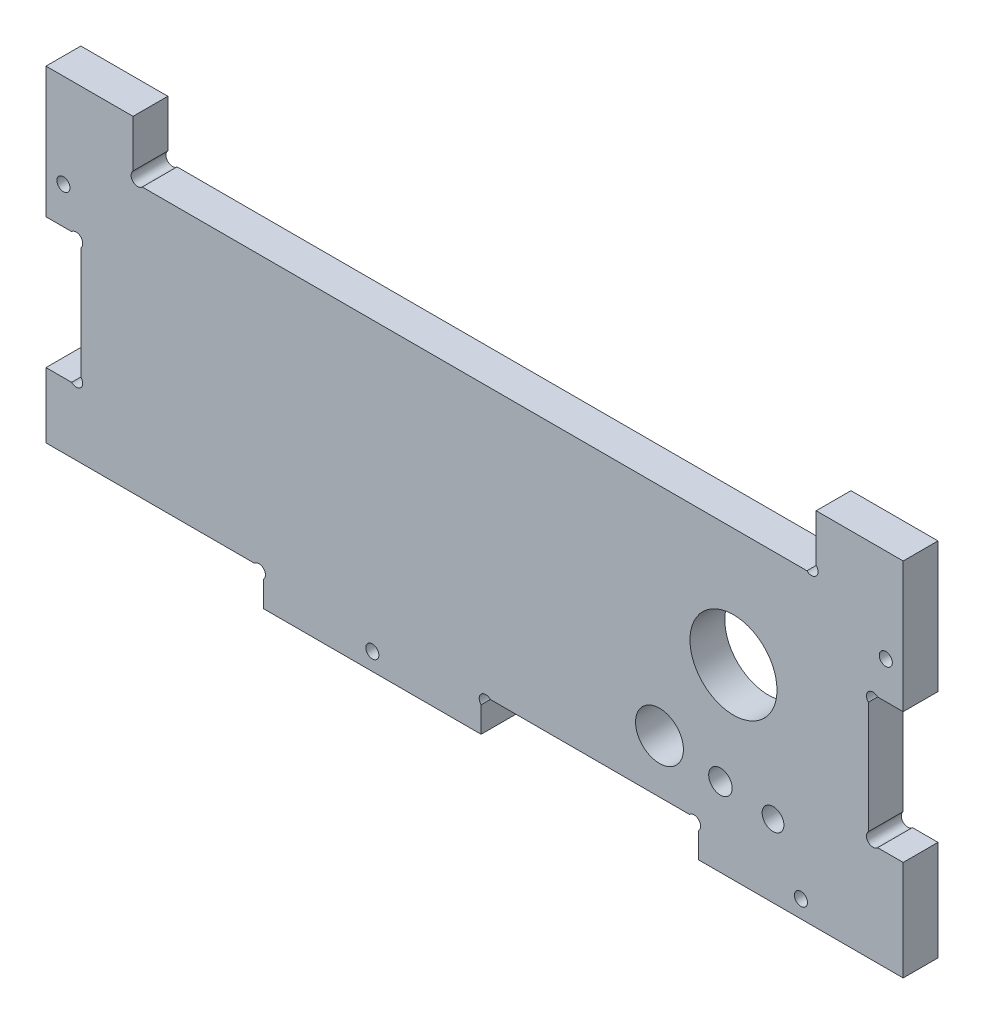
SolidWorks part; units mm, degrees
ref_plane "Plan de face" through (0, 0, 0) normal (0, 0, 1) x (1, 0, 0)
ref_plane "Plan de dessus" through (0, 0, 0) normal (0, 1, 0) x (1, 0, 0)
ref_plane "Plan de droite" through (0, 0, 0) normal (1, 0, 0) x (0, 0, -1)
sketch "Esquisse1" plane through (0, 0, 0) normal (0, 0, 1) x (1, 0, 0)
  line L0 (-176.8157, 28.3831) -> (-176.8157, 45.3831)
  line L1 (20.1843, 45.3831) -> (20.1843, 58.3831)
  line L2 (-176.8157, -16.6169) -> (-176.8157, -1.6169)
  line L3 (20.1843, 45.3831) -> (20.1843, 28.3831)
  line L4 (20.1843, -16.6169) -> (20.1843, -24.6169)
  line L5 (20.1843, -1.6169) -> (14.3056, -1.6169)
  line L6 (12.1843, 0.5044) -> (12.1843, 26.2618)
  line L7 (14.3056, 28.3831) -> (20.1843, 28.3831)
  line L8 (-154.6944, 45.3831) -> (-118.937, 45.3831)
  line L9 (20.1843, -1.6169) -> (20.1843, -16.6169)
  line L10 (-126.8157, -24.6169) -> (-76.8157, -16.6169) construction
  line L11 (20.1843, 58.3831) -> (0.1843, 58.3831)
  line L12 (20.1843, -24.6169) -> (-26.8157, -24.6169)
  line L13 (-26.8157, -24.6169) -> (-26.8157, -18.7382)
  line L14 (-74.6944, -16.6169) -> (-28.937, -16.6169)
  line L15 (-26.8157, -24.6169) -> (20.1843, -16.6169) construction
  line L16 (-76.8157, -18.7382) -> (-76.8157, -24.6169)
  line L17 (-76.8157, -24.6169) -> (-126.8157, -24.6169)
  line L18 (-126.8157, -24.6169) -> (-126.8157, -18.7382)
  line L19 (-128.937, -16.6169) -> (-176.8157, -16.6169)
  line L20 (0.1843, 58.3831) -> (0.1843, 47.5044)
  line L21 (-118.937, 45.3831) -> (-1.937, 45.3831)
  line L22 (-1.937, 47.5044) -> (-12.4859, 58.0533) construction
  line L23 (-176.8157, 45.3831) -> (-176.8157, 58.3831)
  line L24 (-176.8157, 58.3831) -> (-156.8157, 58.3831)
  line L25 (-176.8157, -1.6169) -> (-170.937, -1.6169)
  line L26 (-156.8157, 58.3831) -> (-156.8157, 47.5044)
  line L27 (-168.8157, 0.5044) -> (-168.8157, 26.2618)
  line L28 (-170.937, 28.3831) -> (-176.8157, 28.3831)
  line L29 (12.1843, 28.3831) -> (19.7175, 20.85) construction
  line L30 (-156.8157, 45.3831) -> (-143.6704, 58.5284) construction
  line L31 (-176.8157, 45.3831) -> (-168.8157, 28.3831) construction
  line L32 (12.1843, -1.6169) -> (19.1427, 5.3415) construction
  line L33 (20.1843, 45.3831) -> (12.1843, 28.3831) construction
  circle A0 centre (-35.8243, -4.417) radius 5.5
  arc A1 (-126.8157, -18.7382) -> (-128.937, -16.6169) centre (-127.8763, -17.6775) ccw
  arc A2 (-74.6944, -16.6169) -> (-76.8157, -18.7382) centre (-75.755, -17.6775) ccw
  arc A3 (-26.8157, -18.7382) -> (-28.937, -16.6169) centre (-27.8763, -17.6775) ccw
  circle A4 centre (-35.8343, -4.4169) radius 0.01 construction
  arc A5 (-170.937, -1.6169) -> (-168.8157, 0.5044) centre (-169.8763, -0.5562) ccw
  arc A6 (-168.8157, 26.2618) -> (-170.937, 28.3831) centre (-169.8763, 27.3225) ccw
  circle A7 centre (-21.818, -6.5169) radius 2.7
  arc A8 (-1.937, 45.3831) -> (0.1843, 47.5044) centre (-0.8763, 46.4438) ccw
  circle A9 centre (-101.8157, -20.6169) radius 1.5
  circle A10 centre (-3.3157, -20.6169) radius 1.5
  circle A11 centre (-18.818, 18.1957) radius 10
  arc A12 (-156.8157, 47.5044) -> (-154.6944, 45.3831) centre (-155.755, 46.4438) ccw
  circle A13 centre (16.1843, 36.8831) radius 1.5
  circle A14 centre (-9.7291, -7.9255) radius 2.5
  circle A15 centre (-9.8287, -7.9169) radius 0.1 construction
  arc A16 (14.3056, 28.3831) -> (12.1843, 26.2618) centre (13.245, 27.3225) ccw
  arc A17 (12.1843, 0.5044) -> (14.3056, -1.6169) centre (13.245, -0.5562) ccw
  circle A18 centre (-172.8157, 36.8831) radius 1.5
  dimension "D1" = 50
  dimension "D10" = 47
  dimension "D2" = 45
  dimension "D5" = 45
  dimension "D9" = 50
  dimension "D3" = 20
  dimension "D4" = 45
  dimension "D6" = 45
  dimension "D7" = 50
  dimension "D11" = 8
  dimension "D13" = 20
extrude "Boss.-Extru.1" add sketch "Esquisse1" along normal blind 8
